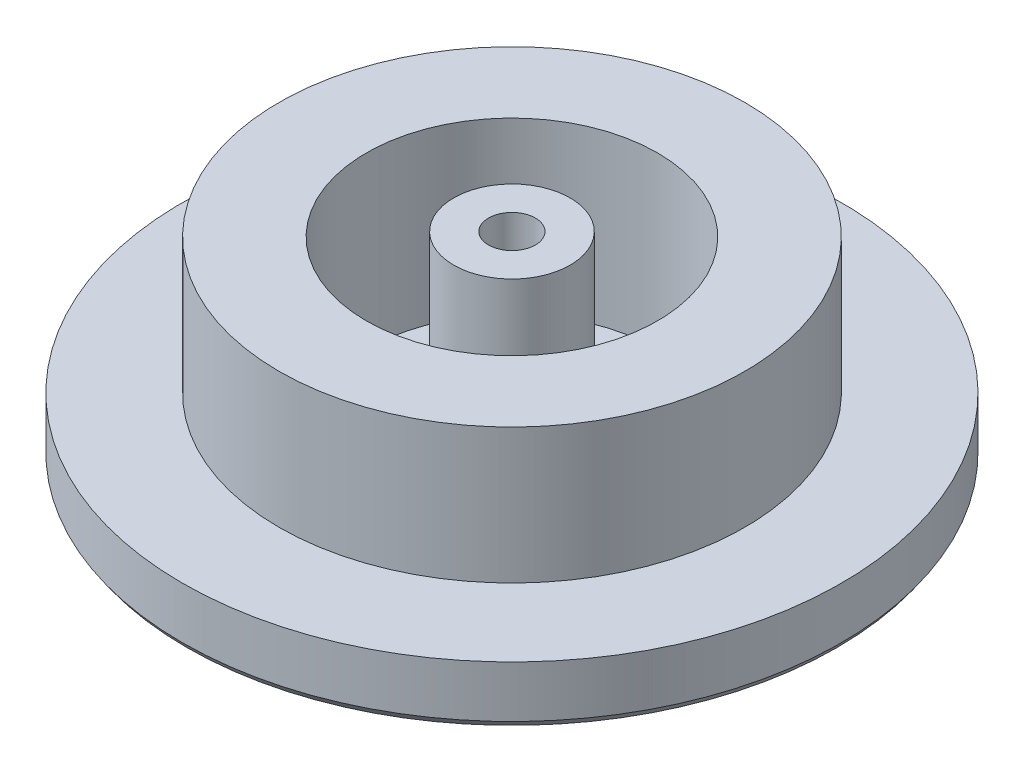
SolidWorks part; units mm, degrees
ref_plane "Front Plane" through (0, 0, 0) normal (0, 0, 1) x (1, 0, 0)
ref_plane "Top Plane" through (0, 0, 0) normal (0, 1, 0) x (1, 0, 0)
ref_plane "Right Plane" through (0, 0, 0) normal (1, 0, 0) x (0, 0, -1)
sketch "Sketch1" plane through (0, 0, 0) normal (0, 0, 1) x (1, 0, 0)
  line L0 (35.941, -15.24) -> (25.4, -15.24)
  line L1 (0, 0) -> (6.35, 0)
  line L2 (0, 0) -> (0, -21.59)
  line L3 (0, -21.59) -> (35.941, -21.59)
  line L4 (35.941, -15.24) -> (35.941, -21.59)
  line L5 (25.4, -15.24) -> (25.4, -0.508)
  line L6 (25.4, -0.508) -> (15.875, -0.508)
  line L7 (15.875, -0.508) -> (15.875, -19.05)
  line L8 (15.875, -19.05) -> (6.35, -19.05)
  line L9 (6.35, -19.05) -> (6.35, 0)
  line L10 (0, 5.7689) -> (0, -23.9898) construction
  dimension "D1" = 35.941
  dimension "D2" = 21.59
  dimension "D3" = 19.05
  dimension "D4" = 6.35
  dimension "D5" = 15.875
  dimension "D6" = 25.4
  dimension "D7" = 0.508
  dimension "D8" = 6.35
revolve "Revolve1" add sketch "Sketch1" angle 360 about L10
chamfer "Chamfer1" distance 0.508 angle 55 1 edges at (0, -21.59, 35.941)
hole_wizard "1/4-20 Tapped Hole1" positions "3DSketch2" profile "Sketch4" tap size "1/4-20" standard "Ansi Inch"
sketch3d "3DSketch2"
  point P0 (0, 0, 0)
  point P3 (0, 0, 0)
sketch "Sketch4" plane through (0, 0, 0) normal (1, 0, 0) x (0, 0, 1)
  line L0 (0, 0) -> (0, 17.5358)
  line L1 (0, 17.5358) -> (2.5527, 16.002)
  line L2 (2.5527, 16.002) -> (2.5527, 0)
  line L5 (2.5527, 0) -> (0, 0)
  line L10 (0, 17.5358) -> (-2.5527, 16.002) construction
  line L11 (0, -6.35) -> (0, 107.95) construction
  dimension "Tap Drill Dia." = 5.1054
  dimension "Tap Drill Depth" = 16.002
  dimension "Drill Angle" = 118
sketch "Sketch5" plane through (0, -21.59, 0) normal (0, -1, 0) x (1, 0, 0)
  circle A0 centre (0, 0) radius 34.925
extrude "chamber volume" [suppressed] add sketch "Sketch5" along normal up to surface (81.2875 mm away)
